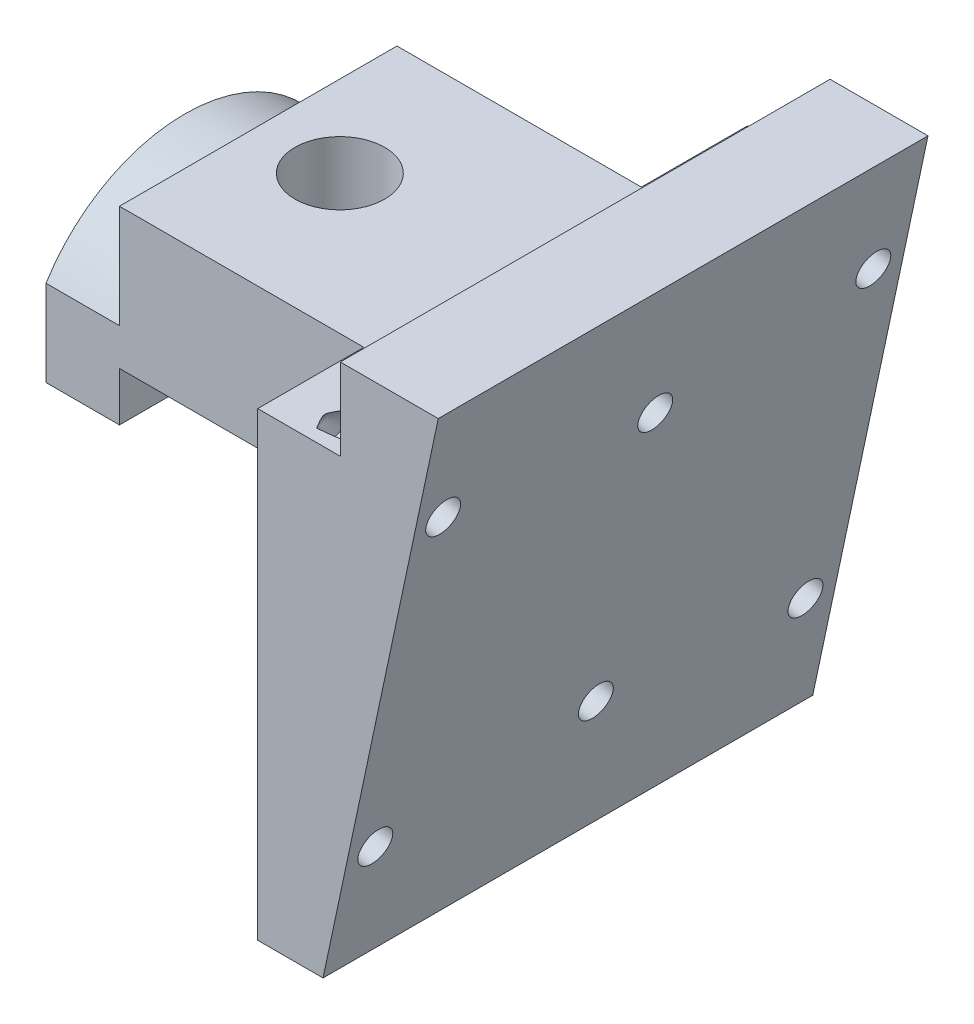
SolidWorks part; units mm, degrees
ref_plane "Face" through (0, 0, 0) normal (0, 0, 1) x (1, 0, 0)
ref_plane "Dessus" through (0, 0, 0) normal (0, 1, 0) x (1, 0, 0)
ref_plane "Droite" through (0, 0, 0) normal (1, 0, 0) x (0, 0, -1)
sketch "Esquisse1" plane through (0, 0, 0) normal (0, 0, 1) x (1, 0, 0)
  line L0 (103.9414, -33.2081) -> (118.0586, 33.2081) construction
  line L1 (103.9414, -33.2081) -> (118.0586, 33.2081)
  line L3 (118.0586, 33.2081) -> (106.0586, 33.2081)
  line L5 (106.0586, 33.2081) -> (106.0586, 23.2081)
  line L7 (106.0586, 23.2081) -> (95.9414, 23.2081)
  line L8 (95.9414, 23.2081) -> (95.9414, -33.2081)
  line L9 (95.9414, -33.2081) -> (103.9414, -33.2081)
  dimension "D1" = 10
  dimension "D2" = 12
  dimension "D3" = 8
extrude "Extrusion1" add sketch "Esquisse1" along normal mid plane 60
sketch "Esquisse2" plane through (0, 0, 0) normal (0, 0, 1) x (1, 0, 0)
  line L1 (66, 6) -> (80, 6) construction
  line L2 (95.9414, 23.2081) -> (57, 23.2081)
  line L3 (57, 23.2081) -> (57, 0)
  line L4 (66, 0) -> (56, 0) construction
  line L5 (57, 0) -> (66, 0)
  line L6 (66, 0) -> (66, 6)
  line L7 (66, 6) -> (95.9414, 6)
  line L8 (95.9414, 23.2081) -> (95.9414, -33.2081) construction
  line L9 (95.9414, 6) -> (95.9414, 23.2081)
  line L10 (66, 6) -> (66, 0) construction
  dimension "D1" = 9
extrude "Extrusion2" add sketch "Esquisse2" along normal mid plane 34
sketch "Esquisse3" plane through (57, 0, 0) normal (-1, 0, 0) x (0, 0, 1)
  circle A0 centre (0, 0) radius 20 construction
  circle A1 centre (0, 0) radius 20
extrude "Enlèv. mat.-Extru.1" cut sketch "Esquisse3" against normal blind 9 flip side to cut
hole_wizard "Trou taraudé M5x0.81" positions "Esquisse6" profile "Esquisse5" tap size "M5x0.8" standard "Ansi Métrique"
sketch "Esquisse6" plane through (106.2018, -22.5739, 0) normal (0.9781, -0.2079, 0) x (0, 0, -1)
  point P1 (26.2, 3.0782)
  point P2 (-26.5, 3.0782)
  point P4 (-26.5, 43.0782)
  point P6 (0, 40.5782)
  point P8 (0, 5.5782)
  point P10 (26.2, 43.0782)
sketch "Esquisse5" plane through (106.8418, -19.563, -26.2) normal (0, 0, 1) x (0.2079, 0.9781, 0)
  line L0 (0, 0) -> (0, 15.2618)
  line L1 (0, 15.2618) -> (2.1, 14)
  line L2 (2.1, 14) -> (2.1, 0)
  line L5 (2.1, 0) -> (0, 0)
  line L10 (0, 15.2618) -> (-2.1, 14) construction
  line L11 (0, -6.35) -> (0, 107.95) construction
  dimension "Diamètre du trou pour taraudage" = 4.2
  dimension "Profondeur du trou pour taraudage" = 14
  dimension "Angle de pointe" = 118
hole_wizard "Dégagement M101" positions "Esquisse8" profile "Esquisse7" hole size "M10" standard "Ansi Métrique"
sketch "Esquisse8" plane through (0, 23.2081, 0) normal (0, 1, 0) x (-1, 0, 0)
  point P1 (-76, 0)
sketch "Esquisse7" plane through (76, 23.2081, 0) normal (1, 0, 0) x (0, 0, 1)
  line L0 (0, 0) -> (0, 56.4162)
  line L1 (0, 56.4162) -> (5.5, 56.4162)
  line L2 (5.5, 56.4162) -> (5.5, 0)
  line L5 (5.5, 0) -> (0, 0)
  line L11 (0, -6.35) -> (0, 107.95) construction
  dimension "Diamètre du perçage jusqu'au prochain" = 11
  dimension "Profondeur du perçage jusqu'au prochain" = 56.4162
